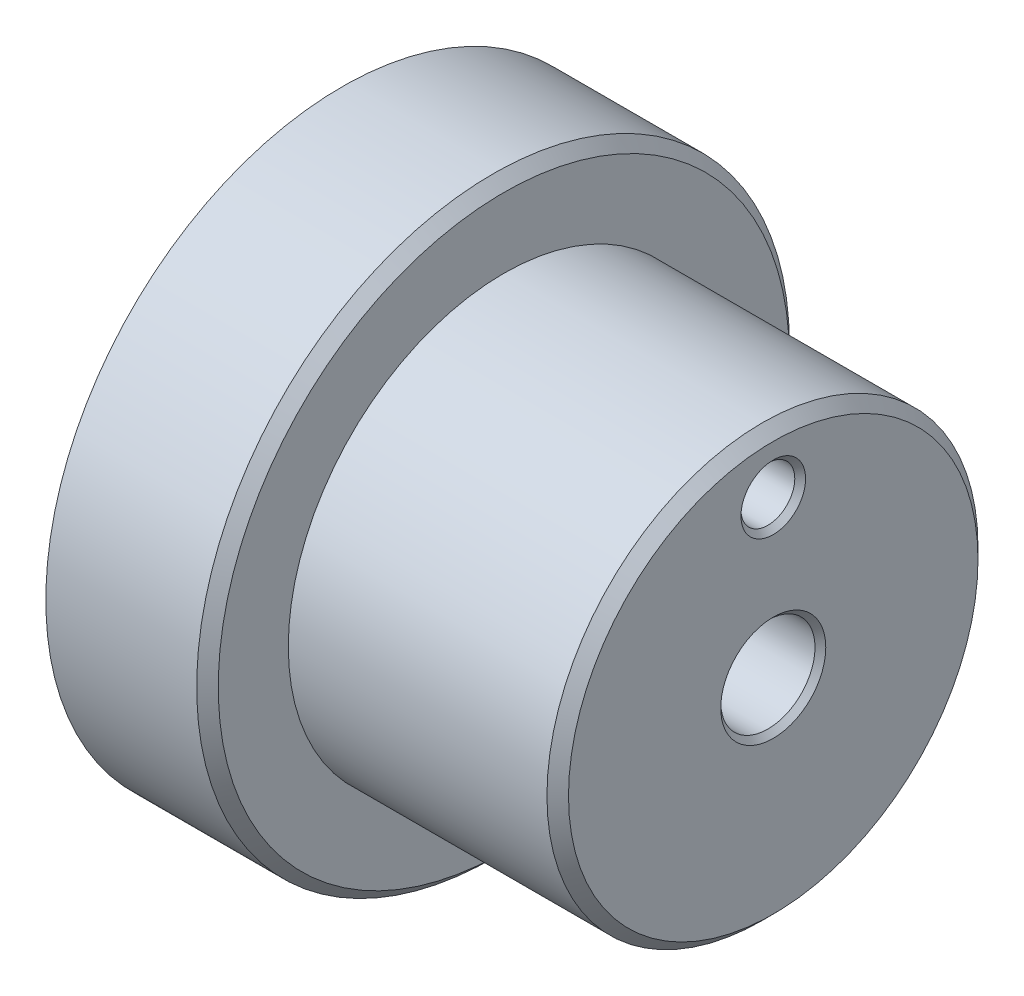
SolidWorks part; units mm, degrees
ref_plane "Płaszczyzna przednia" through (0, 0, 0) normal (0, 0, 1) x (1, 0, 0)
ref_plane "Płaszczyzna górna" through (0, 0, 0) normal (0, 1, 0) x (1, 0, 0)
ref_plane "Płaszczyzna prawa" through (0, 0, 0) normal (1, 0, 0) x (0, 0, -1)
sketch "Szkic1" plane through (0, 0, 0) normal (0, 0, 1) x (1, 0, 0)
  line L0 (0, 0) -> (-81.6322, 0) construction
  line L1 (-47.2934, 55) -> (-47.2934, 45)
  line L2 (-47.2934, 45) -> (-37.2934, 45)
  line L3 (-37.2934, 45) -> (-37.2934, 0)
  line L4 (-37.2934, 0) -> (32.7066, 0)
  line L5 (32.7066, 0) -> (32.7066, 40)
  line L6 (32.7066, 40) -> (-17.2934, 40)
  line L7 (-17.2934, 40) -> (-17.2934, 55)
  line L8 (-17.2934, 55) -> (-47.2934, 55)
  dimension "D1" = 50
  dimension "D2" = 80
  dimension "D3" = 10
  dimension "D4" = 110
  dimension "D5" = 80
  dimension "D6" = 90
revolve "Obrót1" add sketch "Szkic1" angle 360 about L0
chamfer "Sfazowanie1" distance 2 angle 45 2 edges at (-17.2934, 0, -55) (32.7066, 0, -40)
chamfer "Sfazowanie2" distance 1 angle 45 1 edges at (-47.2934, 0, -45)
fillet "Zaokrąglenie1" radius 1 1 edges at (-37.2934, 0, -45)
hole_wizard "Otwór gwintowany M201" positions "Szkic3" profile "Szkic2" tap size "M20" standard "ISO"
sketch "Szkic3" plane through (-37.2934, 0, 0) normal (-1, 0, 0) x (0, 0, 1)
  circle A0 centre (0, 0) radius 55 construction
  point P0 (0, 0)
sketch "Szkic2" plane through (-37.2934, 0, 0) normal (0, 1, 0) x (0, 0, 1)
  line L0 (0, 0) -> (0, 70)
  line L1 (0, 70) -> (8.75, 70)
  line L2 (8.75, 70) -> (8.75, 0)
  line L5 (8.75, 0) -> (0, 0)
  line L11 (0, -6.35) -> (0, 107.95) construction
  dimension "Średnica otworu gwintowanego na wylot" = 17.5
  dimension "Głębokość otworu gwintowanego na wylot" = 70
chamfer "Sfazowanie3" distance 1 angle 45 2 edges at (-37.2934, 0, 8.75) (32.7066, 0, 8.75)
sketch "Szkic4" plane through (0, 0, 0) normal (0, 1, 0) x (1, 0, 0)
  line L0 (-5.2934, 0) -> (18.7066, 0) construction
  line L1 (-5.2934, 8) -> (18.7066, 8)
  line L2 (-5.2934, -8) -> (18.7066, -8)
  line L3 (32.7066, -38) -> (32.7066, 38) construction
  arc A0 (-5.2934, 8) -> (-5.2934, -8) centre (-5.2934, 0) ccw
  arc A1 (18.7066, -8) -> (18.7066, 8) centre (18.7066, 0) ccw
  point P3 (6.7066, 0)
  dimension "D2" = 24
  dimension "D3" = 14
  dimension "D1" = 16
extrude "Wytnij-wyciągnięcie1" cut sketch "Szkic4" against normal through all from offset 32
hole_wizard "Otwór gwintowany M31" positions "Szkic5" profile "Szkic6" tap size "M3" standard "ISO"
sketch "Szkic5" plane through (-37.3945, -32, 0) normal (0, -1, 0) x (1, 0, 0)
  point P0 (56.1011, 0)
  point P1 (32.1011, 0)
sketch "Szkic6" plane through (18.7066, -32, 0) normal (1, 0, 0) x (0, 0, -1)
  line L0 (0, 0) -> (0, 9.2511)
  line L1 (0, 9.2511) -> (1.25, 8.5)
  line L2 (1.25, 8.5) -> (1.25, 0)
  line L5 (1.25, 0) -> (0, 0)
  line L10 (0, 9.2511) -> (-1.25, 8.5) construction
  line L11 (0, -6.35) -> (0, 107.95) construction
  dimension "Średnica wiertła gwintu" = 2.5
  dimension "Głębokość otworu gwintowanego" = 8.5
  dimension "Kąt wiertła" = 118
sketch "Szkic7" plane through (32.7066, 0, 0) normal (1, 0, 0) x (0, 0, -1)
  circle A0 centre (0, 0) radius 29 construction
  point P3 (0, 29)
  dimension "D1" = 58
hole_wizard "Otwór Ø10.0 (10)1" positions "Szkic 3D1" profile "Szkic8" hole size "Ø10.0" standard "ISO"
sketch3d "Szkic 3D1"
  point P0 (32.7066, 29, 0)
sketch "Szkic8" plane through (32.7066, 29, 0) normal (0, 1, 0) x (0, 0, -1)
  line L0 (0, 0) -> (0, 23.0043)
  line L1 (0, 23.0043) -> (5, 20)
  line L2 (5, 20) -> (5, 0)
  line L5 (5, 0) -> (0, 0)
  line L10 (0, 23.0043) -> (-5, 20) construction
  line L11 (0, -6.35) -> (0, 107.95) construction
  dimension "Średnica otworu" = 10
  dimension "Głębokość otworu" = 20
  dimension "Kąt wiertła" = 118
chamfer "Sfazowanie4" distance 1 angle 45 1 edges at (32.7066, 29, -5)
